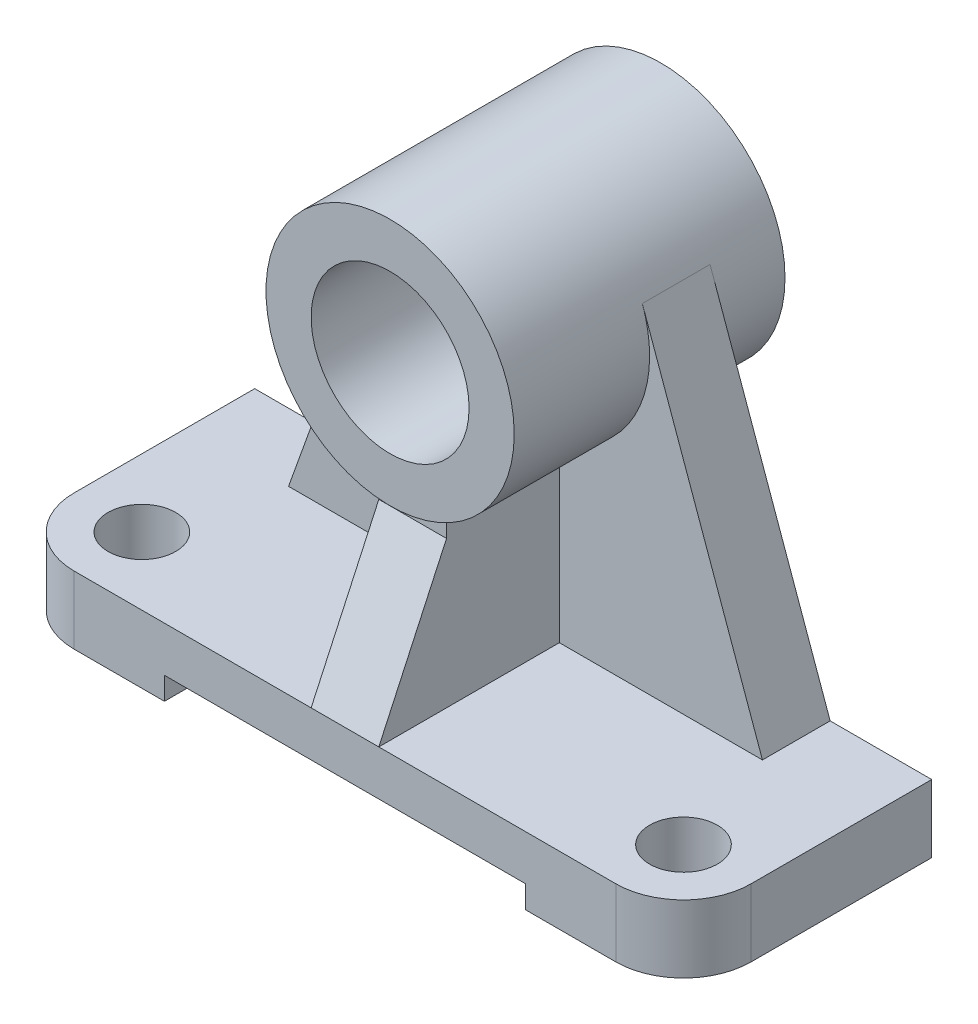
SolidWorks part; units mm, degrees
ref_plane "前视基准面" through (0, 0, 0) normal (0, 0, 1) x (1, 0, 0)
ref_plane "上视基准面" through (0, 0, 0) normal (0, 1, 0) x (1, 0, 0)
ref_plane "右视基准面" through (0, 0, 0) normal (1, 0, 0) x (0, 0, -1)
sketch "草图1" plane through (0, 0, 0) normal (0, 1, 0) x (1, 0, 0)
  line L0 (30, 0) -> (-30, 0)
  line L1 (-30, 0) -> (-30, -16)
  line L2 (-24, -22) -> (24, -22)
  line L3 (0, 24.4123) -> (0, -40.1298) construction
  line L4 (-24, -8.8168) -> (-24, -27.5731) construction
  line L5 (-35.1279, -16) -> (-17.5773, -16) construction
  line L6 (30, 0) -> (30, -16)
  circle A0 centre (-24, -16) radius 3
  arc A1 (-30, -16) -> (-24, -22) centre (-24, -16) ccw
  circle A2 centre (24, -16) radius 3
  arc A3 (30, -16) -> (24, -22) centre (24, -16) cw
  point P15 (-30, -22)
  point P20 (0, -22)
  point P21 (0, 0)
  dimension "D3" = 6
  dimension "D4" = 6
  dimension "D1" = 30
  dimension "D2" = 22
extrude "凸台-拉伸1" add sketch "草图1" along normal blind 6
sketch "草图2" plane through (0, 0, 22) normal (0, 0, 1) x (1, 0, 0)
  line L0 (16, 0) -> (-16, 0)
  line L1 (-24, 0) -> (24, 0) construction
  line L2 (-16, 0) -> (-16, 2)
  line L3 (-16, 2) -> (16, 2)
  line L4 (0, -3.784) -> (0, 11.3172) construction
  line L5 (16, 0) -> (16, 2)
  point P7 (0, 0)
  point P11 (0, 2)
  dimension "D1" = 16
  dimension "D2" = 2
extrude "切除-拉伸1" cut sketch "草图2" against normal through all
ref_plane "基准面1" through (0, 0, -6) normal (0, 0, 1) x (1, 0, 0)
ref_plane "基准面2" through (0, 0, 18) normal (0, 0, 1) x (1, 0, 0)
sketch "草图3" plane through (0, 0, -6) normal (0, 0, 1) x (1, 0, 0)
  line L0 (0, -4.0413) -> (0, 64.9005) construction
  line L1 (-27.9551, 32) -> (38.6747, 32) construction
  circle A0 centre (0, 32) radius 7
  circle A1 centre (0, 32) radius 11
  dimension "D2" = 22
  dimension "D3" = 14
  dimension "D1" = 32
extrude "凸台-拉伸2" add sketch "草图3" along normal blind 24 separate body
sketch "草图4" plane through (0, 0, 0) normal (0, 0, 1) x (1, 0, 0)
  line L0 (0, 53.8311) -> (0, -10.6851) construction
  line L1 (-10.3554, 35.7101) -> (-21, 6)
  line L2 (-24, 6) -> (24, 6) construction
  line L3 (-21, 6) -> (21, 6)
  line L4 (10.3554, 35.7101) -> (21, 6)
  arc A0 (-10.3554, 35.7101) -> (10.3554, 35.7101) centre (0, 32) ccw
  point P12 (0, 6)
  dimension "D1" = 22
  dimension "D2" = 21
extrude "凸台-拉伸3" add sketch "草图4" along normal blind 6
sketch "草图5" plane through (0, 0, 0) normal (1, 0, 0) x (0, 0, -1)
  line L0 (-16, 22.837) -> (-6, 22.837)
  line L1 (-6, 35.7101) -> (-6, 21) construction
  line L2 (-6, 22.837) -> (-6, 6)
  line L3 (-6, 6) -> (-6, 35.7101) construction
  line L4 (-6, 6) -> (-22, 6)
  line L5 (-22, 6) -> (-16, 19)
  line L6 (-16, 19) -> (-16, 22.837)
  dimension "D1" = 10
  dimension "D2" = 13
extrude "凸台-拉伸4" add sketch "草图5" along normal mid plane 6
